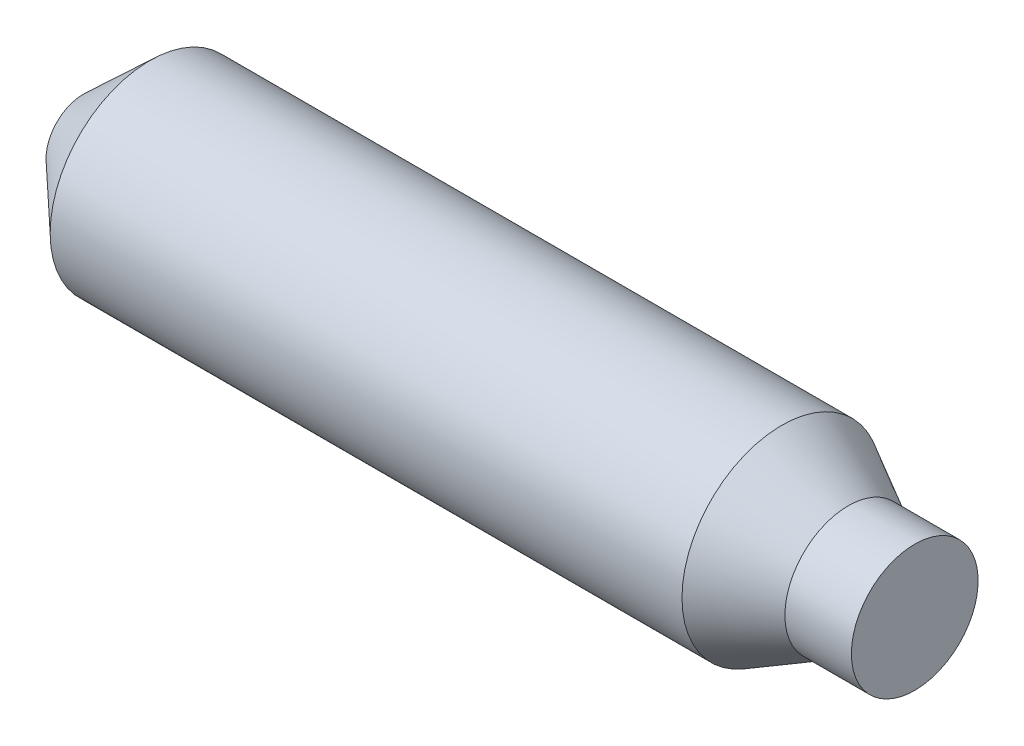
SolidWorks part; units mm, degrees
ref_plane "Face" through (0, 0, 0) normal (0, 0, 1) x (1, 0, 0)
ref_plane "Dessus" through (0, 0, 0) normal (0, 1, 0) x (1, 0, 0)
ref_plane "Droite" through (0, 0, 0) normal (1, 0, 0) x (0, 0, -1)
sketch "Esquisse1" plane through (0, 0, 0) normal (0, 0, 1) x (1, 0, 0)
  line L0 (0, 0) -> (0, 22.5)
  line L1 (0, 22.5) -> (40, 60)
  line L2 (40, 60) -> (420, 60)
  line L3 (420, 60) -> (460, 38.1101)
  line L4 (460, 38.1101) -> (500, 38.1101)
  line L5 (500, 38.1101) -> (500, 0)
  line L6 (500, 0) -> (0, 0)
  line L7 (0, 0) -> (571.9052, 0) construction
  dimension "D1" = 22.5
  dimension "D2" = 500
  dimension "D3" = 60
  dimension "D4" = 40
  dimension "D5" = 40
  dimension "D6" = 80
revolve "Base-Révolution" add sketch "Esquisse1" angle 360 about L7
shell "Coque1" [suppressed] thickness 5
